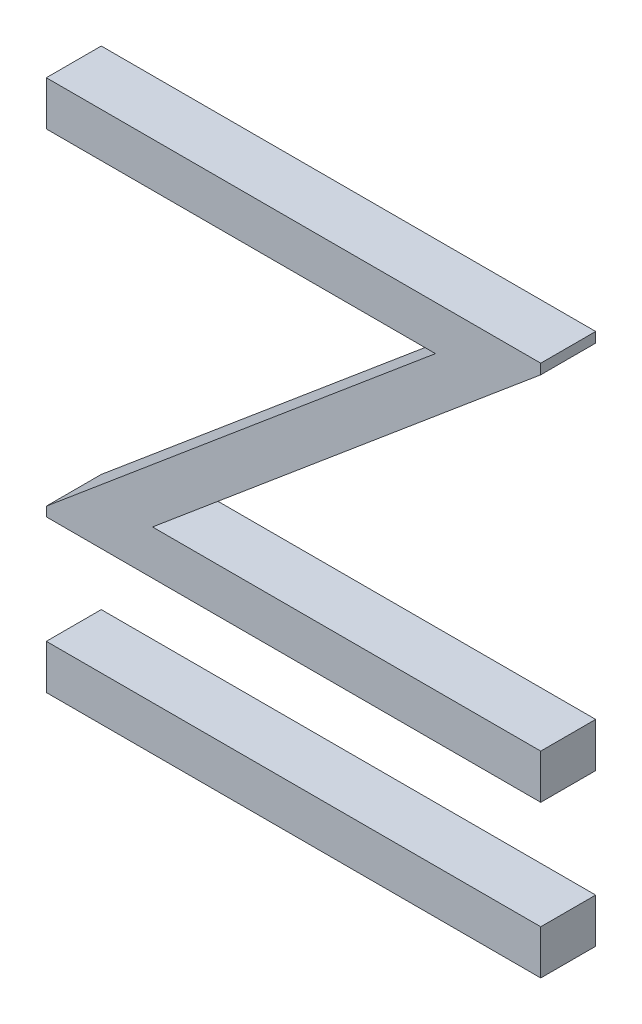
SolidWorks part; units mm, degrees
ref_plane "Piano frontale" through (0, 0, 0) normal (0, 0, 1) x (1, 0, 0)
ref_plane "Piano superiore" through (0, 0, 0) normal (0, 1, 0) x (1, 0, 0)
ref_plane "Piano destro" through (0, 0, 0) normal (1, 0, 0) x (0, 0, -1)
sketch "Schizzo2" plane through (0, 0, 0) normal (0, 0, 1) x (1, 0, 0)
  line L1 (195, 0) -> (195, 1000) construction
  text T0 "IN" font "Century Gothic" height 90
extrude "Estrusione-Estrusione1" add sketch "Schizzo2" along normal blind 10
